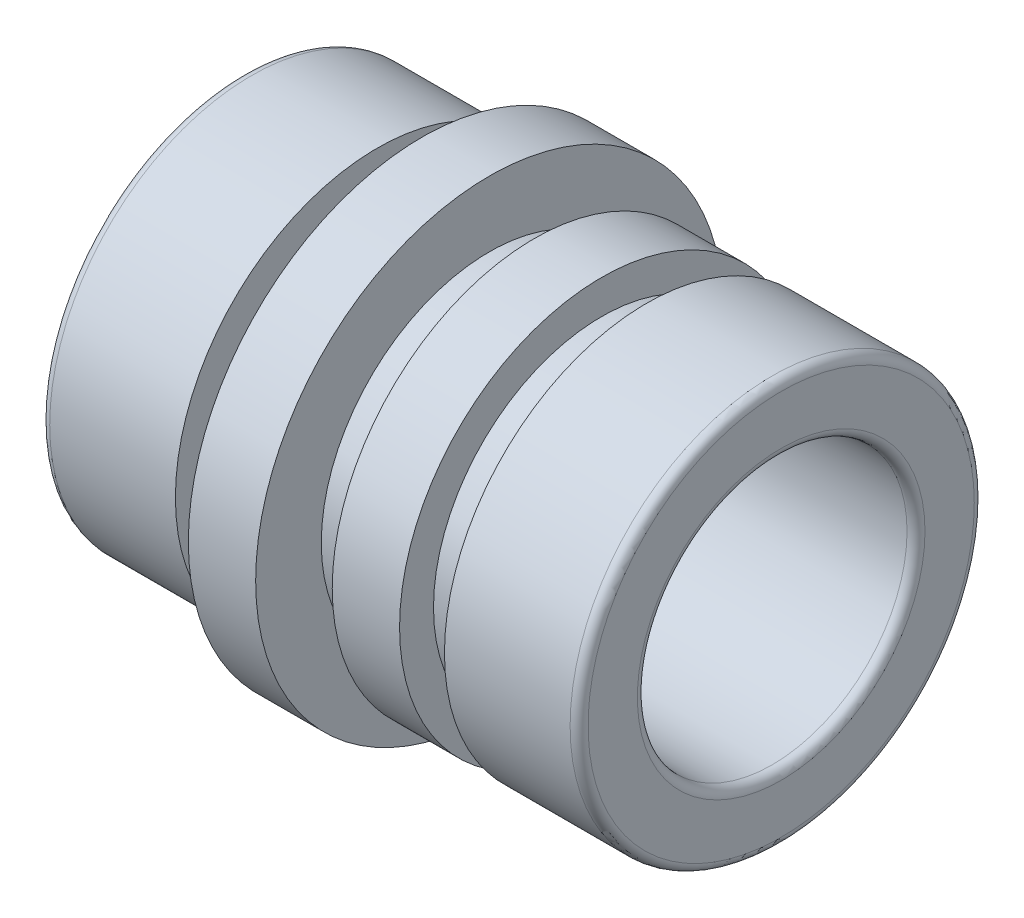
SolidWorks part; units mm, degrees
ref_plane "Plane1" through (0, 0, 0) normal (0, 0, 1) x (1, 0, 0)
ref_plane "Plane2" through (0, 0, 0) normal (0, 1, 0) x (1, 0, 0)
ref_plane "Plane3" through (0, 0, 0) normal (1, 0, 0) x (0, 0, -1)
sketch "Sketch1" plane through (0, 15.24, 0) normal (0, 0, 1) x (1, 0, 0)
  line L0 (-12.7, -0.9652) -> (-3.175, -0.9652)
  line L1 (-3.175, -0.9652) -> (-3.175, -3.3465)
  line L2 (-3.175, -3.3465) -> (0, -3.3465)
  line L3 (0, -3.3465) -> (0, 1.2954)
  line L4 (0, 1.2954) -> (4.7625, 1.2954)
  line L5 (4.7625, 1.2954) -> (4.7625, -3.3465)
  line L6 (4.7625, -3.3465) -> (7.9375, -3.3465)
  line L7 (7.9375, -3.3465) -> (7.9375, -0.9462)
  line L8 (7.9375, -0.9462) -> (12.7, -0.9462)
  line L9 (12.7, -0.9462) -> (12.7, -3.3465)
  line L10 (12.7, -3.3465) -> (15.875, -3.3465)
  line L11 (15.875, -3.3465) -> (15.875, -0.9462)
  line L12 (15.875, -0.9462) -> (25.4, -0.9462)
  line L13 (25.4, -0.9462) -> (25.4, -5.7023)
  line L14 (25.4, -5.7023) -> (-12.7, -5.7023)
  line L15 (-12.7, -5.7023) -> (-12.7, -0.9652)
  line L16 (-36.83, -15.24) -> (66.04, -15.24) construction
  dimension "M" = 19.0754
  dimension "H" = 28.5877
  dimension "F" = 33.0708
  dimension "S" = 28.5496
  dimension "D5" = 4.7625
  dimension "A" = 25.4
  dimension "L" = 38.1
  dimension "G" = 12.7
  dimension "D9" = 3.175
  dimension "D10" = 2.3813
revolve "Base-Revolve" add sketch "Sketch1" angle 360 about L16
fillet "Fillet1" radius 0.635 4 edges at (-12.7, 0, 14.2748) (25.4, 0, 14.2938) (25.4, 0, 9.5377) (-12.7, 0, 9.5377)
